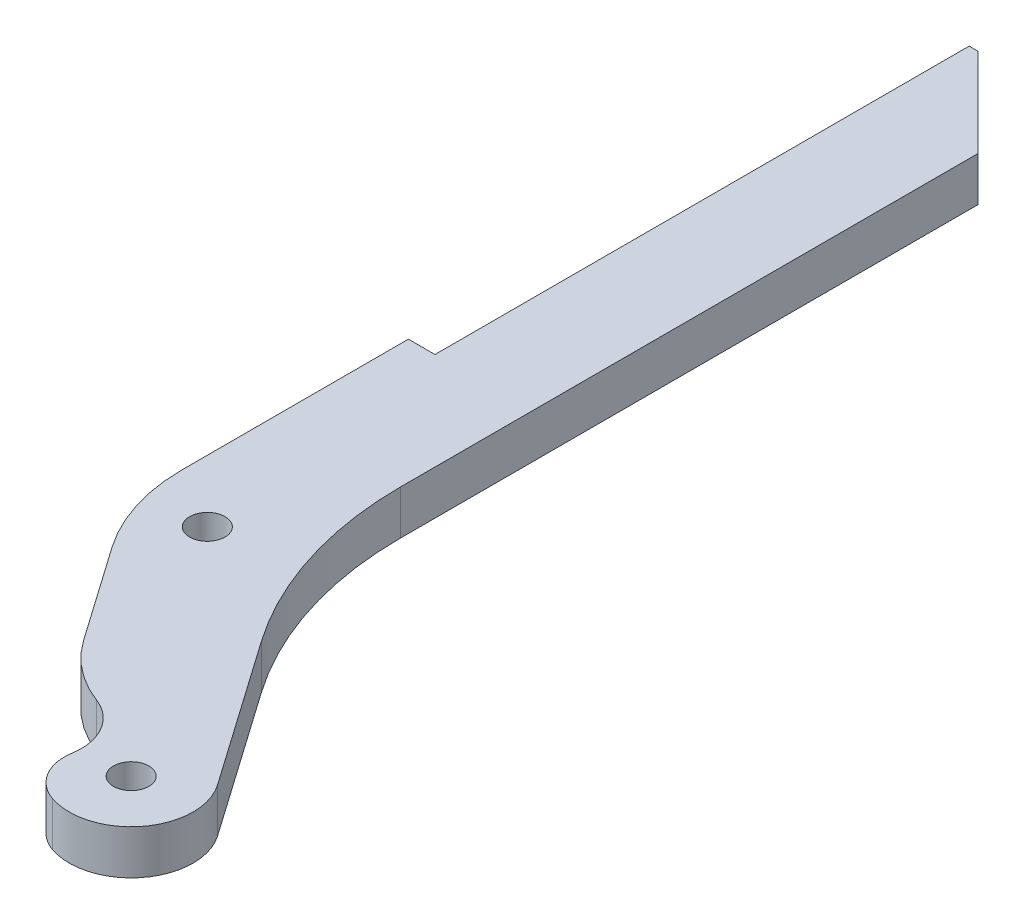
SolidWorks part; units mm, degrees
ref_plane "Front Plane" through (0, 0, 0) normal (0, 0, 1) x (1, 0, 0)
ref_plane "Top Plane" through (0, 0, 0) normal (0, 1, 0) x (1, 0, 0)
ref_plane "Right Plane" through (0, 0, 0) normal (1, 0, 0) x (0, 0, -1)
sketch "Sketch1" plane through (0, 0, 0) normal (0, 1, 0) x (1, 0, 0)
  line L0 (0, 0) -> (0, 90) construction
  line L1 (0, 0) -> (20.0752, -28.6703) construction
  line L2 (7, 2.2071) -> (25.8092, -24.6553)
  line L3 (7, 2.2071) -> (7, 90)
  line L4 (-7, -2.2071) -> (14.3411, -32.6854)
  line L5 (-7, -2.2071) -> (-7, 90)
  line L6 (-7, 90) -> (7, 90)
  arc A0 (14.3411, -32.6854) -> (25.8092, -24.6553) centre (20.0752, -28.6703) ccw
  circle A1 centre (0, 0) radius 2
  circle A2 centre (20.0752, -28.6703) radius 2
  dimension "D6" = 4
  dimension "D1" = 145
  dimension "D2" = 90
  dimension "D3" = 35
  dimension "D4" = 7
  dimension "D5" = 7
extrude "Boss-Extrude3" add sketch "Sketch1" along normal blind 5
fillet "Fillet1" radius 40 1 edges at (7, 2.5, -2.2071)
fillet "Fillet2" radius 20 1 edges at (-7, 2.5, 2.2071)
chamfer "Chamfer1" distance 10 angle 45 1 edges at (7, 2.5, -90)
sketch "Sketch2" plane through (-7, 0, 0) normal (-1, 0, 0) x (0, 0, 1)
  line L0 (-90, 0) -> (-4.0989, 0) construction
  line L1 (-90, 5) -> (-30, 5) construction
  line L2 (-90, 5) -> (-90, 0) construction
  line L3 (-90, 0) -> (-30, 0) construction
  line L4 (-30, 5) -> (-30, 0) construction
  line L5 (-90, 5) -> (-30, 0) construction
  line L6 (-90, 0) -> (-30, 5) construction
  line L7 (-60, 5) -> (-60, 0) construction
  line L8 (-60, 2.5) -> (-90, 2.5) construction
  circle A0 centre (-75, 2.5) radius 1.5
  circle A1 centre (-45, 2.5) radius 1.5
  point P4 (-60, 2.5)
  dimension "D2" = 3
  dimension "D1" = 60
extrude "Cut-Extrude1" cut sketch "Sketch2" against normal blind 10 contours A0
sketch "Sketch3" plane through (-7, 0, 0) normal (-1, 0, 0) x (0, 0, 1)
  line L0 (-75, 2.5) -> (-45, 2.5) construction
  line L1 (-60, 2.5) -> (-60, 5) construction
  line L2 (-90, 5) -> (-4.0989, 5) construction
  line L3 (-90, 5) -> (-90, 0) construction
  line L4 (-29.7, 0) -> (-90.3, 0)
  line L5 (-29.7, 0) -> (-29.7, 5)
  line L6 (-29.7, 5) -> (-90.3, 5)
  line L7 (-90.3, 0) -> (-90.3, 5)
  line L8 (-29.7, 0) -> (-90.3, 5) construction
  line L9 (-29.7, 5) -> (-90.3, 0) construction
  dimension "D1" = 0.3
extrude "Cut-Extrude2" cut sketch "Sketch3" against normal blind 3
sketch "Sketch4" plane through (0, 5, 0) normal (0, 1, 0) x (1, 0, 0)
  line L0 (20.0752, -28.6703) -> (16.3469, -23.3458) construction
  line L1 (0, 0) -> (20.0752, -28.6703) construction
  line L2 (16.3469, -23.3458) -> (8.565, -28.7948) construction
  circle A0 centre (8.565, -28.7948) radius 6
  dimension "D3" = 12
  dimension "D1" = 6.5
  dimension "D2" = 9.5
extrude "Cut-Extrude3" cut sketch "Sketch4" against normal up to next
fillet "Fillet3" radius 14 2 edges at (7.4844, 2.5, 22.8929) (13.7414, 2.5, 31.8288)
fillet "Fillet4" radius 5 1 edges at (14.3411, 2.5, 32.6854)
